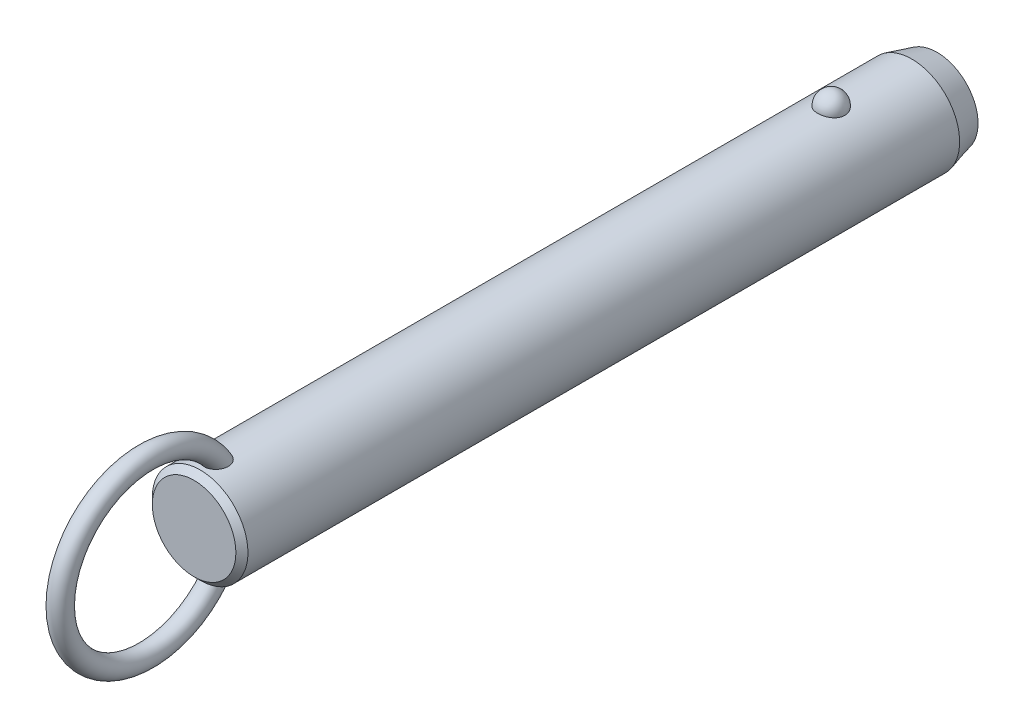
SolidWorks part; units mm, degrees
ref_plane "Front Plane" through (0, 0, 0) normal (0, 0, 1) x (1, 0, 0)
ref_plane "Top Plane" through (0, 0, 0) normal (0, 1, 0) x (1, 0, 0)
ref_plane "Right Plane" through (0, 0, 0) normal (1, 0, 0) x (0, 0, -1)
sketch "Sketch2" plane through (0, 0, 0) normal (0, 0, 1) x (1, 0, 0)
  circle A0 centre (0, 0) radius 9.5
  point P3 (0, 9.5)
  dimension "D1" = 19
extrude "Boss-Extrude1" add sketch "Sketch2" along normal blind 114.3
sketch "Sketch3" plane through (0, 0, 0) normal (0, 0, -1) x (-1, 0, 0)
  circle A0 centre (0, 0) radius 9.5
  dimension "D1" = 19
extrude "Boss-Extrude2" add sketch "Sketch3" along normal blind 23.7
chamfer "Chamfer1" distance 5 angle 15 1 edges at (-9.5, 0, -23.7)
sketch "Sketch12" plane through (0, 0, 0) normal (1, 0, 0) x (0, 0, -1)
  line L0 (-114.3, 9.5) -> (-114.3, -9.5) construction
  point P0 (-114.3, 0)
sketch "Sketch13" plane through (0, 0, 0) normal (1, 0, 0) x (0, 0, -1)
  circle A0 centre (-133.35, 0) radius 19.05
  point P2 (-114.3, 0)
  dimension "D1" = 38.1
sketch "Sketch14" plane through (0, 0, 0) normal (0, 1, 0) x (1, 0, 0)
  circle A0 centre (0, -116.3) radius 2
  point P2 (0, -114.3)
  dimension "D1" = 4
sweep "Sweep1" add profiles "Sketch14" path "Sketch13"
sketch "Sketch15" plane through (0, 0, 114.3) normal (0, 0, 1) x (1, 0, 0)
  circle A0 centre (0, 0) radius 9.5
  dimension "D1" = 19
extrude "Boss-Extrude3" add sketch "Sketch15" along normal blind 9.52
chamfer "Chamfer2" distance 1.2 angle 45 1 edges at (9.5, 0, 123.82)
sketch "Sketch18" plane through (0, 0, 0) normal (1, 0, 0) x (0, 0, -1)
  line L0 (18.7, 9.5) -> (-116.8378, 9.5) construction
  line L1 (2.7, 12.2) -> (2.7, 6.8)
  line L2 (-116.8378, -9.5) -> (18.7, -9.5) construction
  arc A0 (2.7, 12.2) -> (2.7, 6.8) centre (2.7, 9.5) ccw
  point P4 (0, 9.5)
  dimension "D1" = 21.7
revolve "Revolve1" add sketch "Sketch18" angle 360 about L1
